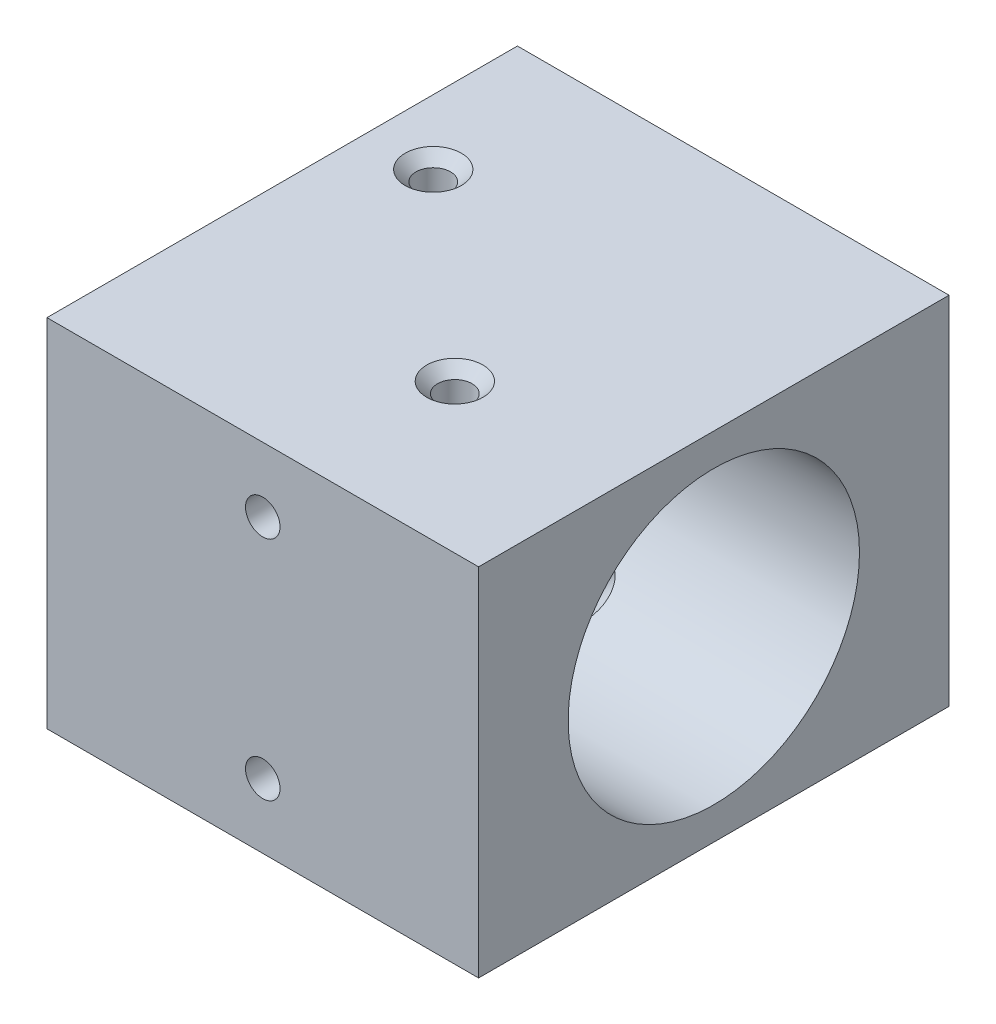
SolidWorks part; units mm, degrees
ref_plane "Plan de face" through (0, 0, 0) normal (0, 0, 1) x (1, 0, 0)
ref_plane "Plan de dessus" through (0, 0, 0) normal (0, 1, 0) x (1, 0, 0)
ref_plane "Plan de droite" through (0, 0, 0) normal (1, 0, 0) x (0, 0, -1)
ref_plane "Plan1" through (0, 16.5, 0) normal (0, 1, 0) x (1, 0, 0)
sketch "Esquisse1" plane through (0, 16.5, 0) normal (0, 1, 0) x (1, 0, 0)
  line L0 (-40, 21.8) -> (-40, -21.8)
  line L1 (-40, -21.8) -> (0, -21.8)
  line L2 (0, -21.8) -> (0, 21.8)
  line L3 (0, 21.8) -> (-40, 21.8)
extrude "Boss.-Extru.1" add sketch "Esquisse1" against normal blind 33
hole_wizard "Diamètre du perçage Ø24.5 (24.5)1" positions "Esquisse3" profile "Esquisse2" hole size "Ø24.5" standard "Ansi Metric"
sketch "Esquisse3" plane through (-40, 0, 0) normal (-1, 0, 0) x (0, 0, 1)
  point P0 (0, 0)
sketch "Esquisse2" plane through (-40, 0, 0) normal (0, 1, 0) x (0, 0, 1)
  line L0 (0, 0) -> (0, 40)
  line L1 (0, 40) -> (13, 40)
  line L2 (13, 40) -> (13, 0)
  line L5 (13, 0) -> (0, 0)
  line L11 (0, -6.35) -> (0, 107.95) construction
  dimension "Diamètre du perçage jusqu'au prochain" = 26
  dimension "Profondeur du perçage jusqu'au prochain" = 40
hole_wizard "Diamètre du perçage Ø3.2 (3.2)3" positions "Esquisse5" profile "Esquisse4" hole size "Ø3.2" standard "ISO"
sketch "Esquisse5" plane through (0, 0, 21.8) normal (0, 0, 1) x (1, 0, 0)
  point P0 (-20, 10.5)
  point P1 (-20, -10.5)
sketch "Esquisse4" plane through (-20, 10.5, 21.8) normal (1, 0, 0) x (0, -1, 0)
  line L0 (0, 0) -> (0, 58.6)
  line L1 (0, 58.6) -> (1.6, 58.6)
  line L2 (1.6, 58.6) -> (1.6, 0)
  line L5 (1.6, 0) -> (0, 0)
  line L10 (0, 58.6) -> (-1.6, 58.6) construction
  line L11 (0, -6.35) -> (0, 107.95) construction
  dimension "Diamètre du perçage" = 3.2
  dimension "Profondeur du perçage" = 58.6
  dimension "Angle de pointe" = 180
hole_wizard "Diamètre du perçage Ø3.2 (3.2)2" positions "Esquisse7" profile "Esquisse6" hole size "Ø3.2" standard "Ansi Metric"
sketch "Esquisse7" plane through (0, 16.5, 0) normal (0, 1, 0) x (1, 0, 0)
  point P0 (-16, -8)
  point P1 (-34, 8)
sketch "Esquisse6" plane through (-16, 16.5, 8) normal (1, 0, 0) x (0, 0, 1)
  line L0 (0, 0) -> (0, 6.253)
  line L1 (0, 6.253) -> (1.6, 6.253)
  line L2 (1.6, 6.253) -> (1.6, 0)
  line L5 (1.6, 0) -> (0, 0)
  line L11 (0, -6.35) -> (0, 107.95) construction
  dimension "Diamètre du perçage jusqu'au prochain" = 3.2
  dimension "Profondeur du perçage jusqu'au prochain" = 6.253
chamfer "Chanfrein1" distance 1 angle 45 2 edges at (-34, 16.5, -6.4) (-16, 16.5, 9.6)
sketch "Esquisse14" plane through (0, 0, 0) normal (1, 0, 0) x (0, 0, -1)
  line L0 (0, 13) -> (0, -13) construction
  line L1 (-13, 0) -> (13, 0) construction
  line L2 (0, 18.15) -> (0, -18.15) construction
  circle A0 centre (0, 0) radius 13 construction
  circle A1 centre (0, 0) radius 13.5
  dimension "D1" = 27
extrude "Enlèv. mat.-Extru.1" cut sketch "Esquisse14" against normal blind 25
thread "Filetage2" pitch 1.5 start angle 0, offset 0, length 0, pitch 1.5, diameter 26
ref_plane "Plan4" through (-40, 0, -13) normal (0, -1, 0) x (0, 0, -1)
sketch "Profil de filetage3" plane through (-40, 0, -13) normal (0, -1, 0) x (0, 0, -1)
  line L0 (0, 0) -> (0, 1.5) construction
  line L11 (0, 0) -> (0, 1.3125)
  line L12 (0, 1.3125) -> (-0.8119, 0.8437)
  line L13 (-0.8119, 0.8437) -> (-0.8119, 0.4687)
  line L15 (-0.8119, 0.4687) -> (0, 0)
  line L17 (-0.8119, 0.6562) -> (0, 0.6562) construction
  point P2 (0, 0)
  dimension "Pitch" = 1.5
  dimension "Profile_Angle" = 60
  dimension "Profile_Land" = 0.375
  dimension "Profile_Height" = 0.8119
